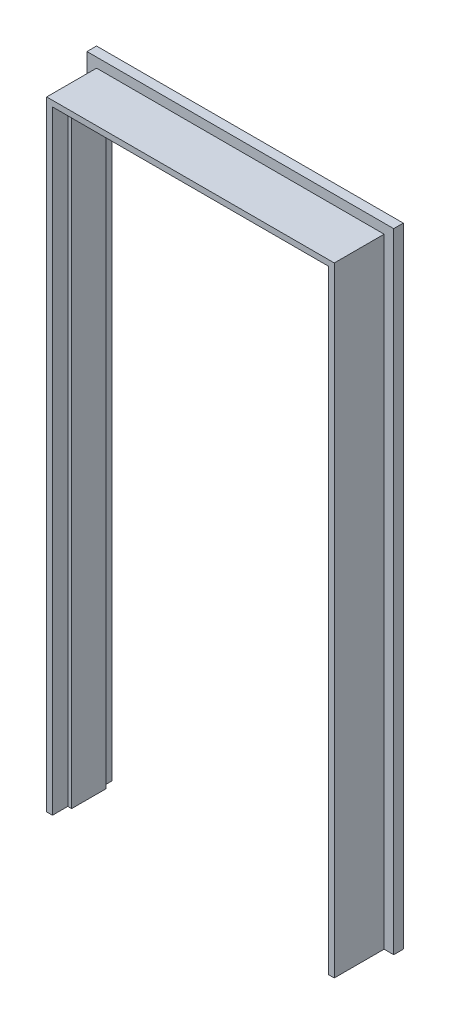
SolidWorks part; units mm, degrees
ref_plane "Front Plane" through (0, 0, 0) normal (0, 0, 1) x (1, 0, 0)
ref_plane "Top Plane" through (0, 0, 0) normal (0, 1, 0) x (1, 0, 0)
ref_plane "Right Plane" through (0, 0, 0) normal (1, 0, 0) x (0, 0, -1)
sketch "Top Sketch" plane through (0, 0, 0) normal (0, 1, 0) x (1, 0, 0)
  line L0 (0, -165.1) -> (0, 0) construction
  line L1 (0, -90.805) -> (0, 90.805) construction
  line L3 (-124.785, -114.3) -> (124.785, -114.3) construction
  point P8 (0, -114.3)
  dimension "D1" = 50.8
  dimension "D2" = 165.1
sketch "Sketch1" plane through (0, 0, 0) normal (0, 0, 1) x (1, 0, 0)
  line L0 (-476.25, 0) -> (-476.25, 2051.05)
  line L1 (-457.2, 0) -> (457.2, 0) construction
  line L2 (-457.2, 0) -> (-457.2, 2032)
  line L3 (-457.2, 2032) -> (457.2, 2032)
  line L4 (457.2, 0) -> (457.2, 2032)
  line L5 (-457.2, 0) -> (457.2, 2032) construction
  line L6 (-457.2, 2032) -> (457.2, 0) construction
  line L7 (-476.25, 2051.05) -> (476.25, 2051.05)
  line L8 (476.25, 0) -> (476.25, 2051.05)
  line L9 (-476.25, 0) -> (-457.2, 0)
  line L10 (457.2, 0) -> (476.25, 0)
  line L11 (90.805, 0) -> (-90.805, 0) construction
  line L12 (0, 0) -> (0, 2032) construction
  point P0 (0, 1016)
  dimension "D1" = 914.4
  dimension "D2" = 2032
  dimension "D3" = 19.05
extrude "Frame" add sketch "Sketch1" along normal up to vertex (165.1 mm away)
sketch "Sketch2" plane through (0, 0, 0) normal (0, 0, -1) x (-1, 0, 0)
  line L0 (-457.2, 0) -> (-457.2, 2032)
  line L2 (-457.2, 2032) -> (457.2, 2032)
  line L3 (457.2, 2032) -> (457.2, 0)
  line L5 (457.2, 2032) -> (-457.2, 2032) construction
  line L8 (-508, 0) -> (-508, 2082.8)
  line L9 (-508, 2082.8) -> (508, 2082.8)
  line L10 (508, 2082.8) -> (508, 0)
  line L11 (-508, 0) -> (-457.2, 0)
  line L13 (457.2, 0) -> (508, 0)
  line L14 (-457.2, 2032) -> (-457.2, 0) construction
  line L15 (457.2, 0) -> (457.2, 2032) construction
  line L16 (476.25, 0) -> (457.2, 0) construction
  line L17 (-457.2, 0) -> (-476.25, 0) construction
  dimension "D1" = 50.8
extrude "Ext Brick Molding" add sketch "Sketch2" along normal blind 31.75 separate body
sketch "Sketch3" plane through (0, 0, 0) normal (0, 0, 1) x (1, 0, 0)
  line L0 (-444.5, 0) -> (-444.5, 2019.3)
  line L1 (-457.2, 0) -> (-444.5, 0)
  line L2 (457.2, 0) -> (457.2, 2032)
  line L3 (457.2, 2032) -> (-457.2, 2032)
  line L4 (-457.2, 0) -> (-457.2, 2032)
  line L5 (444.5, 2019.3) -> (-444.5, 2019.3)
  line L6 (444.5, 0) -> (444.5, 2019.3)
  line L7 (-444.5, 12.7) -> (-444.5, 2019.3) construction
  line L8 (444.5, 12.7) -> (-444.5, 12.7) construction
  line L9 (457.2, 0) -> (-457.2, 0) construction
  line L10 (-476.25, 0) -> (-457.2, 0) construction
  line L11 (444.5, 12.7) -> (444.5, 2019.3) construction
  line L12 (457.2, 2032) -> (457.2, 0) construction
  line L14 (457.2, 0) -> (444.5, 0)
  dimension "D1" = 12.7
extrude "Door Stop Molding" add sketch "Sketch3" along normal up to vertex (114.3 mm away)
sketch "Hinge Lines" plane through (0, 0, 165.1) normal (0, 0, 1) x (1, 0, 0)
  line L0 (454.025, 2028.825) -> (454.025, 0) construction
  line L2 (457.2, 0) -> (476.25, 0) construction
  line L3 (457.2, 2032) -> (457.2, 0) construction
  line L4 (0, 2051.05) -> (0, 0) construction
  line L5 (476.25, 2051.05) -> (-476.25, 2051.05) construction
  line L6 (-454.025, 2028.825) -> (-454.025, 0) construction
  line L7 (-454.025, 2028.825) -> (454.025, 2028.825) construction
  line L8 (-457.2, 2032) -> (457.2, 2032) construction
  line L9 (454.025, 0) -> (-454.025, 0) construction
  line L10 (-454.025, 22.225) -> (454.025, 22.225) construction
  dimension "D1" = 3.175
  dimension "D2" = 908.05
  dimension "D3" = 3.175
  dimension "D4" = 2006.6
  dimension "D5" = 22.225
